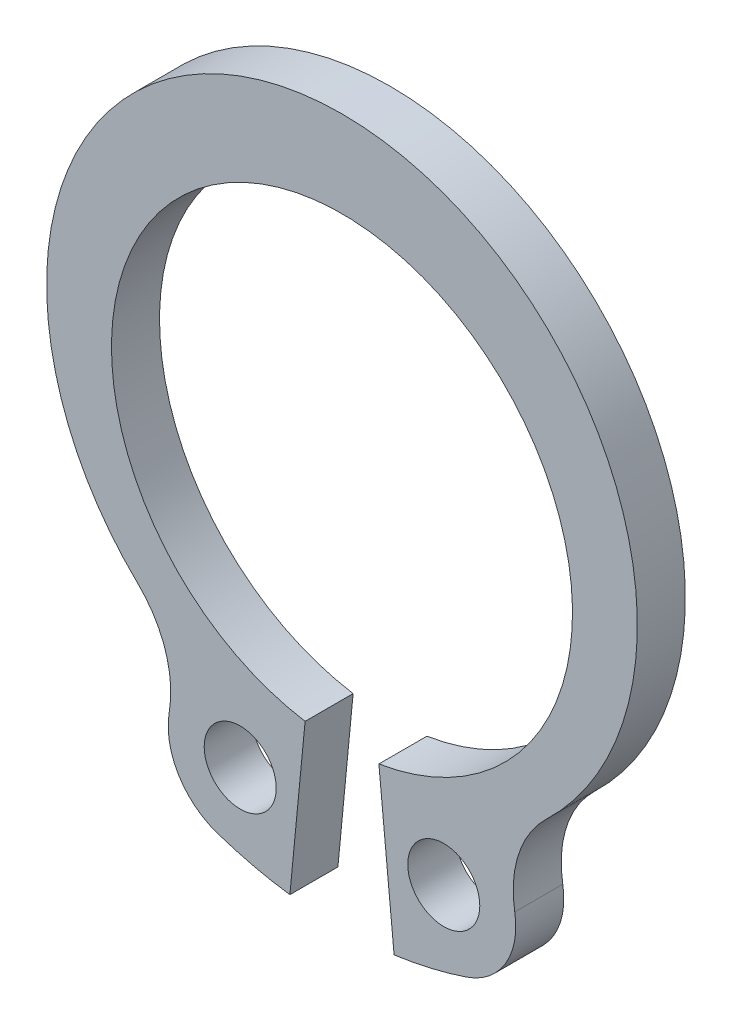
SolidWorks part; units mm, degrees
ref_plane "Face" through (0, 0, 0) normal (0, 0, 1) x (1, 0, 0)
ref_plane "Dessus" through (0, 0, 0) normal (0, 1, 0) x (1, 0, 0)
ref_plane "Droite" through (0, 0, 0) normal (1, 0, 0) x (0, 0, -1)
sketch "Esquisse1" plane through (0, 0, 0) normal (0, 0, 1) x (1, 0, 0)
  line L0 (0, 6.6) -> (0, 4.8) construction
  line L1 (0.7681, -4.7381) -> (1.085, -8.0229)
  line L2 (-0.7681, -4.7381) -> (-1.085, -8.0229)
  line L3 (0.3, -4.6403) -> (0.3, -7.9403) construction
  line L4 (-0.3, -4.6403) -> (-0.3, -7.9403) construction
  arc A0 (0.7681, -4.7381) -> (-0.7681, -4.7381) centre (0, 0) ccw
  arc A1 (4.2575, -3.9881) -> (-4.2575, -3.9881) centre (0, 0.45) ccw
  arc A2 (1.085, -8.0229) -> (2.6011, -7.6667) centre (0, 0) ccw
  circle A3 centre (2.1192, -6.2462) radius 0.75
  arc A4 (2.6011, -7.6667) -> (3.5975, -5.9924) centre (2.1192, -6.2462) ccw
  arc A5 (4.2575, -3.9881) -> (3.5975, -5.9924) centre (5.8151, -5.6117) ccw
  circle A6 centre (-2.1192, -6.2462) radius 0.75
  arc A7 (-4.2575, -3.9881) -> (-3.5975, -5.9924) centre (-5.8151, -5.6117) cw
  arc A8 (-2.6011, -7.6667) -> (-3.5975, -5.9924) centre (-2.1192, -6.2462) cw
  arc A9 (-1.085, -8.0229) -> (-2.6011, -7.6667) centre (0, 0) cw
  arc A10 (0.3, -4.6403) -> (-0.3, -4.6403) centre (0, 0) ccw construction
  circle A11 centre (0, 0) radius 5 construction
  dimension "dgorge" = 9.6
  dimension "D3" = 0.45
  dimension "dtrou" = 1.5
  dimension "D8" = 1.5
  dimension "D9" = 2.25
  dimension "dint" = 9.3
  dimension "dn" = 10
  dimension "b" = 1.8
  dimension "a" = 3.3
  dimension "D5" = 18.417
  dimension "D7" = 1.2
  dimension "D12" = 0.6
  dimension "D13" = 7.398
  dimension "D14" = 5.509
extrude "Base-Extrusion" add sketch "Esquisse1" along normal blind 1
equation "\"D3@Esquisse1\" = \"b@Esquisse1\"/4"
equation "\"D7@Esquisse1\"=\"dtrou@Esquisse1\"*0.8"
equation "\"D8@Esquisse1\" = \"dtrou@Esquisse1\""
equation "\"D9@Esquisse1\" = \"dtrou@Esquisse1\"*1.5"
equation "\"D12@Esquisse1\" = \"dtrou@Esquisse1\"*0.4"
equation "\"D5@Esquisse1\" = 360-(360-\"D13@Esquisse1\")*\"dint@Esquisse1\"/\"dgorge@Esquisse1\""
equation "\"D14@Esquisse1\" = (\"D5@Esquisse1\"-\"D13@Esquisse1\")/2"
